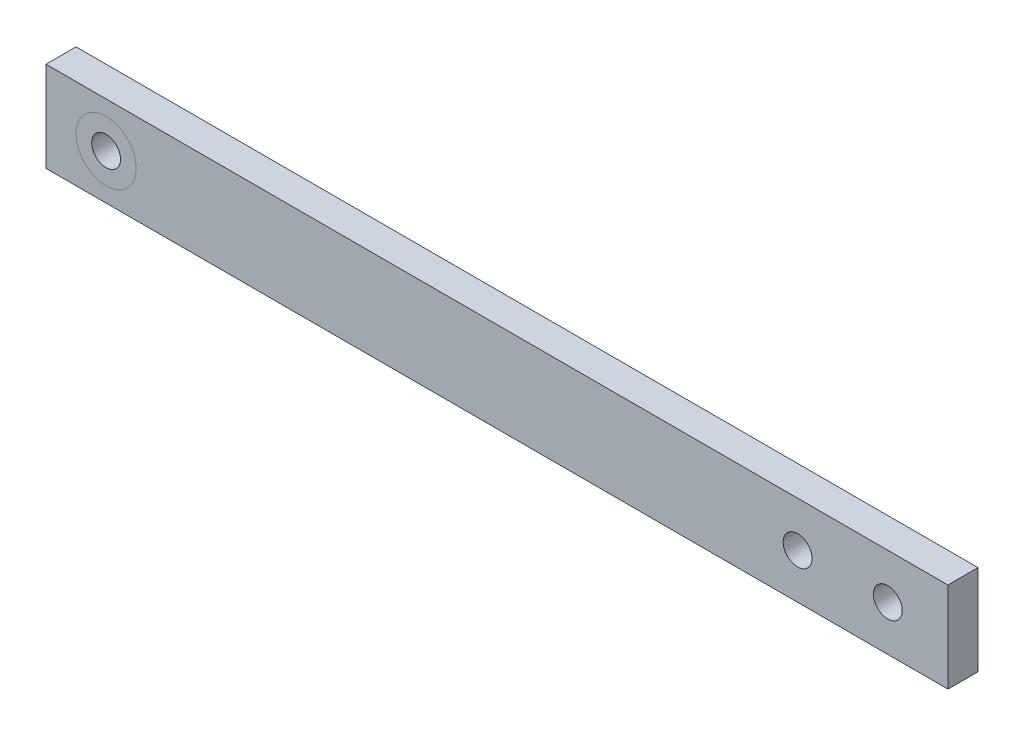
SolidWorks part; units mm, degrees
ref_plane "Front Plane" through (0, 0, 0) normal (0, 0, 1) x (1, 0, 0)
ref_plane "Top Plane" through (0, 0, 0) normal (0, 1, 0) x (1, 0, 0)
ref_plane "Right Plane" through (0, 0, 0) normal (1, 0, 0) x (0, 0, -1)
sketch "Sketch1" plane through (0, 0, 0) normal (0, 0, 1) x (1, 0, 0)
  line L1 (0, 0) -> (381, 0)
  line L2 (0, 0) -> (0, 38.1)
  line L3 (0, 38.1) -> (381, 38.1)
  line L4 (381, 0) -> (381, 38.1)
  dimension "D1" = 38.1
  dimension "D2" = 381
extrude "Extrude1" add sketch "Sketch1" along normal blind 12.7
sketch "Sketch2" plane through (0, 0, 12.7) normal (0, 0, 1) x (1, 0, 0)
  line L0 (0, 19.05) -> (381, 19.05) construction
  line L1 (0, 38.1) -> (0, 0) construction
  line L2 (381, 0) -> (381, 38.1) construction
  circle A0 centre (355.6, 19.05) radius 6.1
  dimension "D1" = 12.2
  dimension "D2" = 25.4
extrude "Cut-Extrude1" cut sketch "Sketch2" against normal through all
sketch "Sketch3" plane through (-27.7873, -2.7761, 12.7) normal (0, 0, 1) x (1, 0, 0)
  line L0 (27.7873, 21.8261) -> (156.0817, 21.8261) construction
  line L3 (27.7873, 40.8761) -> (27.7873, 2.7761) construction
  circle A0 centre (345.2873, 21.8261) radius 6.1
  circle A1 centre (383.3873, 21.8261) radius 6.1 construction
  dimension "D1" = 12.2
  dimension "D2" = 38.1
extrude "Cut-Extrude2" cut sketch "Sketch3" against normal through all
sketch "Sketch4" plane through (0, 0, 12.7) normal (0, 0, 1) x (1, 0, 0)
  line L4 (381, 38.1) -> (0, 38.1) construction
  circle A0 centre (25.4, 19.05) radius 6.1
  dimension "D1" = 12.2
  dimension "D2" = 25.4
  dimension "D3" = 19.05
extrude "Cut-Extrude3" cut sketch "Sketch4" against normal through all
sketch "Sketch6" plane through (0, 0, 0) normal (0, 0, -1) x (-1, 0, 0)
  line L0 (-292.1, 38.1) -> (-292.1, 0)
  line L1 (-381, 38.1) -> (0, 38.1) construction
  line L2 (0, 0) -> (-381, 0) construction
  dimension "D1" = 88.9
sketch "Sketch7" plane through (0, 0, 12.7) normal (0, 0, 1) x (1, 0, 0)
  circle A0 centre (25.4, 19.05) radius 12.7
